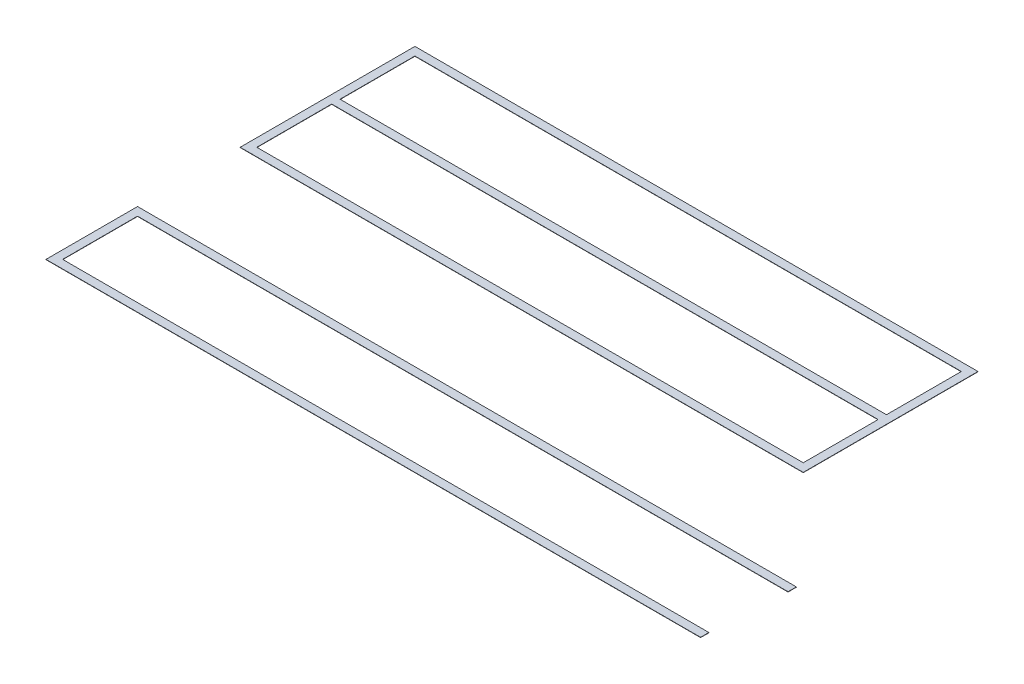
SolidWorks part; units mm, degrees
ref_plane "Plan de face" through (0, 0, 0) normal (0, 0, 1) x (1, 0, 0)
ref_plane "Plan de dessus" through (0, 0, 0) normal (0, 1, 0) x (1, 0, 0)
ref_plane "Plan de droite" through (0, 0, 0) normal (1, 0, 0) x (0, 0, -1)
sketch "Esquisse1" plane through (0, 0, 0) normal (0, 1, 0) x (1, 0, 0)
  line L0 (-1103.1972, 0) -> (1134.1813, 0) construction
  line L1 (-1000, 901.9763) -> (-1000, -572.0761) construction
  line L2 (1000, 877.0332) -> (1000, -663.3976) construction
  line L3 (-1080.3668, -200) -> (1078.7361, -200) construction
  line L4 (-1126.0276, 200) -> (1062.4287, 200) construction
  line L5 (-1080.3668, -500) -> (1227.1336, -500) construction
  line L6 (-1080.3668, 500) -> (1078.7361, 500) construction
  line L7 (-1080.3668, 800) -> (1078.7361, 800) construction
  line L8 (-985, 485) -> (-985, 215)
  line L9 (1360.2196, -185) -> (1360.2196, -215)
  line L10 (1344.8682, -485) -> (1344.8682, -515)
  line L11 (985, 485) -> (985, 215)
  line L17 (-985, 485) -> (985, 485)
  line L18 (-1015, 815) -> (1015, 815)
  line L19 (1015, 815) -> (1015, 185)
  line L20 (-1015, 185) -> (1015, 185)
  line L21 (-1015, 815) -> (-1015, 185)
  line L22 (-1015, -185) -> (1360.2196, -185)
  line L24 (-1015, -515) -> (1344.8682, -515)
  line L25 (-1015, -185) -> (-1015, -515)
  line L26 (-985, 515) -> (985, 515)
  line L27 (-985, 785) -> (985, 785)
  line L28 (985, 785) -> (985, 515)
  line L29 (-985, 215) -> (985, 215)
  line L30 (-985, 785) -> (-985, 515)
  line L31 (-985, -215) -> (1360.2196, -215)
  line L33 (-985, -485) -> (1344.8682, -485)
  line L34 (-985, -215) -> (-985, -485)
extrude "Extrusion1" add sketch "Esquisse1" along normal blind 1
